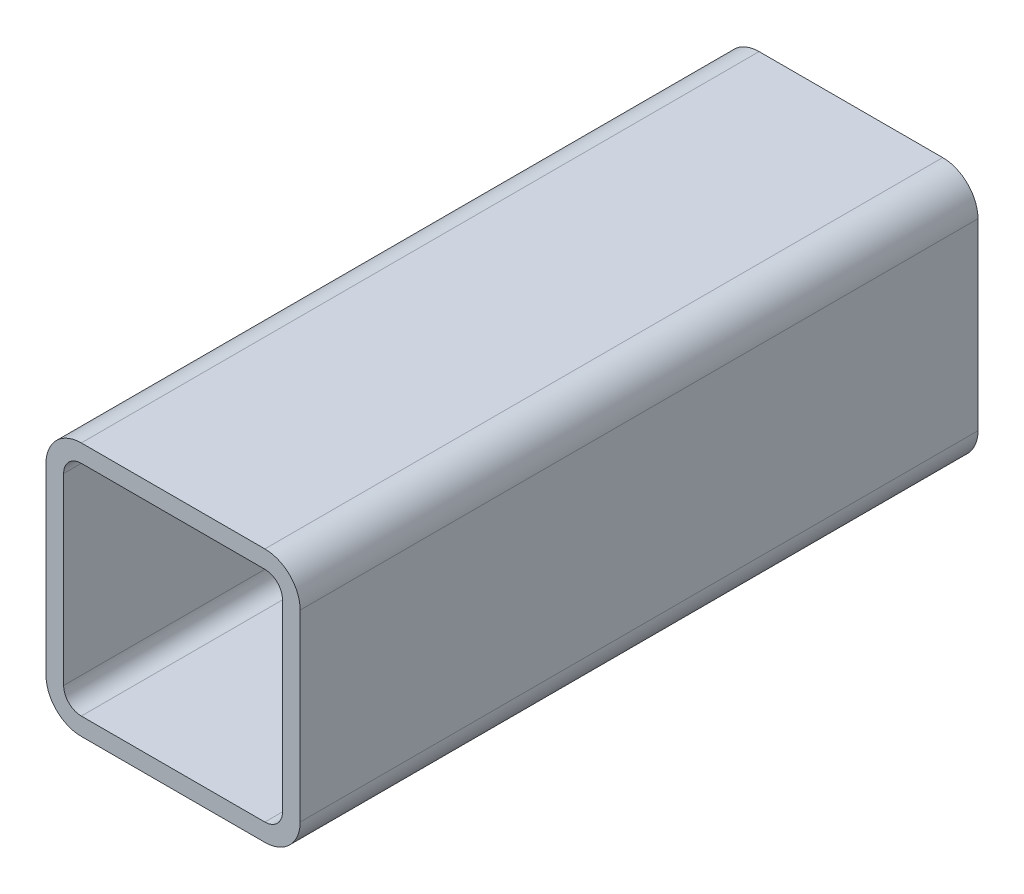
SolidWorks part; units mm, degrees
ref_plane "Front Plane" through (0, 0, 0) normal (0, 0, 1) x (1, 0, 0)
ref_plane "Top Plane" through (0, 0, 0) normal (0, 1, 0) x (1, 0, 0)
ref_plane "Right Plane" through (0, 0, 0) normal (1, 0, 0) x (0, 0, -1)
sketch "Sketch1" plane through (0, 0, 0) normal (0, 0, 1) x (1, 0, 0)
sketch_block_instance "HSS4.5x4.5x0.3125-1"
sketch_block "HSS4.5x4.5x0.3125"
extrude "Boss-Extrude1" add sketch "Sketch1" along normal blind 304.8
